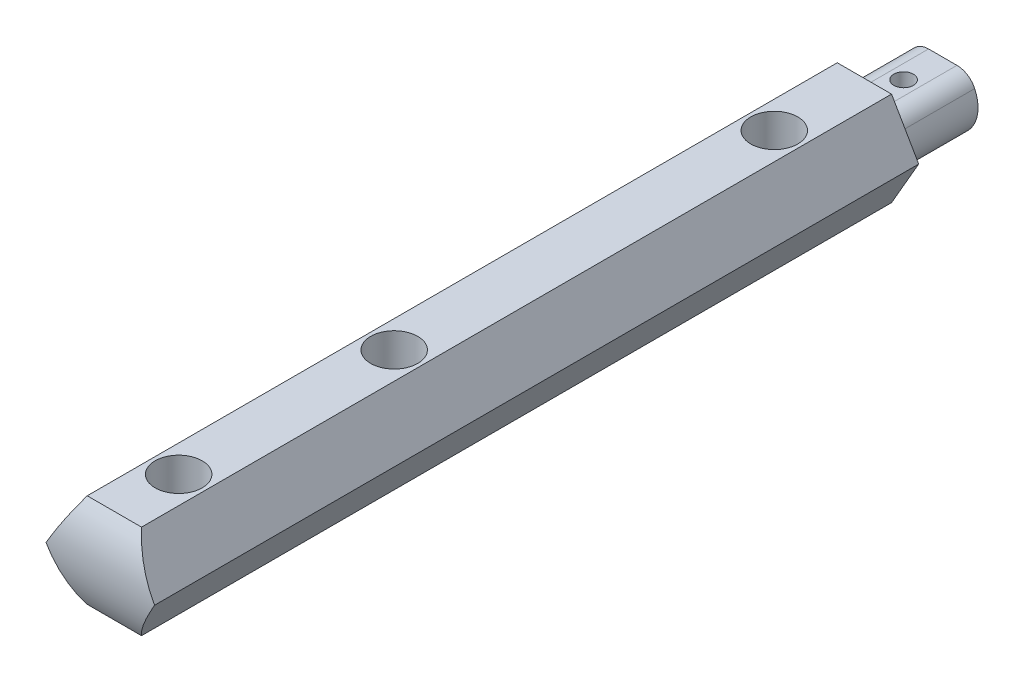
SolidWorks part; units mm, degrees
ref_plane "前视基准面" through (0, 0, 0) normal (0, 0, 1) x (1, 0, 0)
ref_plane "上视基准面" through (0, 0, 0) normal (0, 1, 0) x (1, 0, 0)
ref_plane "右视基准面" through (0, 0, 0) normal (1, 0, 0) x (0, 0, -1)
sketch "草图1" plane through (0, 0, 0) normal (0, 0, 1) x (1, 0, 0)
  line L1 (-13.8564, 0) -> (-6.9282, -12)
  line L2 (-6.9282, -12) -> (6.9282, -12)
  line L3 (6.9282, -12) -> (13.8564, 0)
  line L4 (13.8564, 0) -> (6.9282, 12)
  line L5 (6.9282, 12) -> (-6.9282, 12)
  line L6 (-6.9282, 12) -> (-13.8564, 0)
  circle A0 centre (0, 0) radius 12 construction
  dimension "D1" = 24
extrude "凸台-拉伸1" add sketch "草图1" along normal blind 195
sketch "草图2" plane through (0, 0, 0) normal (0, 0, -1) x (-1, 0, 0)
  line L0 (-3.6208, 6.7) -> (3.6208, 6.7)
  arc A0 (-8.1467, 3.825) -> (8.1467, 3.825) centre (0, 0) ccw
  arc A1 (8.1467, 3.825) -> (3.6208, 6.7) centre (3.6208, 1.7) ccw
  arc A2 (-3.6208, 6.7) -> (-8.1467, 3.825) centre (-3.6208, 1.7) ccw
  point P1 (0, -9)
  dimension "D1" = 9
  dimension "D3" = 5
  dimension "D2" = 15.7
extrude "凸台-拉伸2" add sketch "草图2" along normal blind 20
sketch "草图3" plane through (0, 0, 0) normal (1, 0, 0) x (0, 0, -1)
  line L0 (-195, 12) -> (0, 12) construction
  line L1 (-195, -12) -> (0, -12) construction
  line L2 (-195, 12) -> (-195, 0) construction
  line L3 (-191.4092, 12) -> (-211.6747, 15.2164)
  line L4 (-211.6747, 15.2164) -> (-211.6747, -17.7698)
  line L5 (-211.6747, -17.7698) -> (-191.4092, -12)
  arc A0 (-191.4092, 12) -> (-191.4092, -12) centre (-173.1533, 0) ccw
extrude "切除-拉伸2" cut sketch "草图3" against normal through all both and the other way through all
sketch "草图8" plane through (0, 0, 0) normal (1, 0, 0) x (0, 0, -1)
  line L0 (-175, 27.7354) -> (-175, -33.5259) construction
  line L1 (-80.9357, 27.7354) -> (-80.9357, -33.5259) construction
  line L2 (-56.9024, 27.7354) -> (-56.9024, -33.5259) construction
  line L3 (-169, 12) -> (-169, 0)
  line L4 (-191.4092, 12) -> (0, 12) construction
  line L5 (-195, 0) -> (0, 0) construction
  line L6 (-169, 0) -> (-170.9944, 0)
  line L7 (-170.9944, 0) -> (-170.9944, -12)
  line L8 (-191.4092, -12) -> (0, -12) construction
  line L9 (-170.9944, -12) -> (-175, -12)
  line L10 (-169, 12) -> (-175, 12)
  line L11 (-175, -12) -> (-175, 12)
  line L12 (0, -9) -> (0, 3.825) construction
  dimension "D1" = 6
  dimension "D2" = 4.0056
  dimension "D3" = 175
revolve "切除-旋转2" cut sketch "草图8" angle 360 about L11
ref_plane "基准面2" through (13.8564, 0, 0) normal (-0.5, 0.866, 0) x (0.866, 0.5, 0)
pattern_linear "阵列(线性)1" count 2 spacing 55 along (0, 0, -1) of "切除-旋转2"
sketch "草图12" plane through (0, 0, 0) normal (1, 0, 0) x (0, 0, -1)
  line L0 (-23, 21.5129) -> (-23, -22.7825) construction
  line L1 (-23, 12) -> (-29, 12)
  line L2 (-191.4092, 12) -> (0, 12) construction
  line L3 (-29, 12) -> (-29, -3)
  line L4 (-29, -3) -> (-26.25, -3)
  line L5 (-26.25, -3) -> (-26.25, -12)
  line L6 (-191.4092, -12) -> (0, -12) construction
  line L7 (-26.25, -12) -> (-23, -12)
  line L8 (-23, 12) -> (-23, -12)
  dimension "D1" = 23
  dimension "D2" = 15
  dimension "D3" = 6
  dimension "D4" = 3.25
revolve "切除-旋转3" cut sketch "草图12" angle 360 about L0
hole_wizard "M6 螺纹孔1" positions "草图13" profile "草图15" tap size "M6" standard "GB"
sketch "草图13" plane through (0, 6.7, 0) normal (0, 1, 0) x (1, 0, 0)
  line L0 (-3.6208, 0) -> (3.6208, 0) construction
  point P0 (0, 10)
  point P5 (0, 0)
  dimension "D1" = 10
sketch "草图15" plane through (0, 6.7, -10) normal (1, 0, 0) x (0, 0, 1)
  line L0 (0, 0) -> (0, 18.7)
  line L1 (0, 18.7) -> (2.5, 18.7)
  line L2 (2.5, 18.7) -> (2.5, 0)
  line L5 (2.5, 0) -> (0, 0)
  line L11 (0, -6.35) -> (0, 107.95) construction
  dimension "通孔螺纹孔钻头直径" = 5
  dimension "通孔螺纹孔钻头深度" = 18.7
